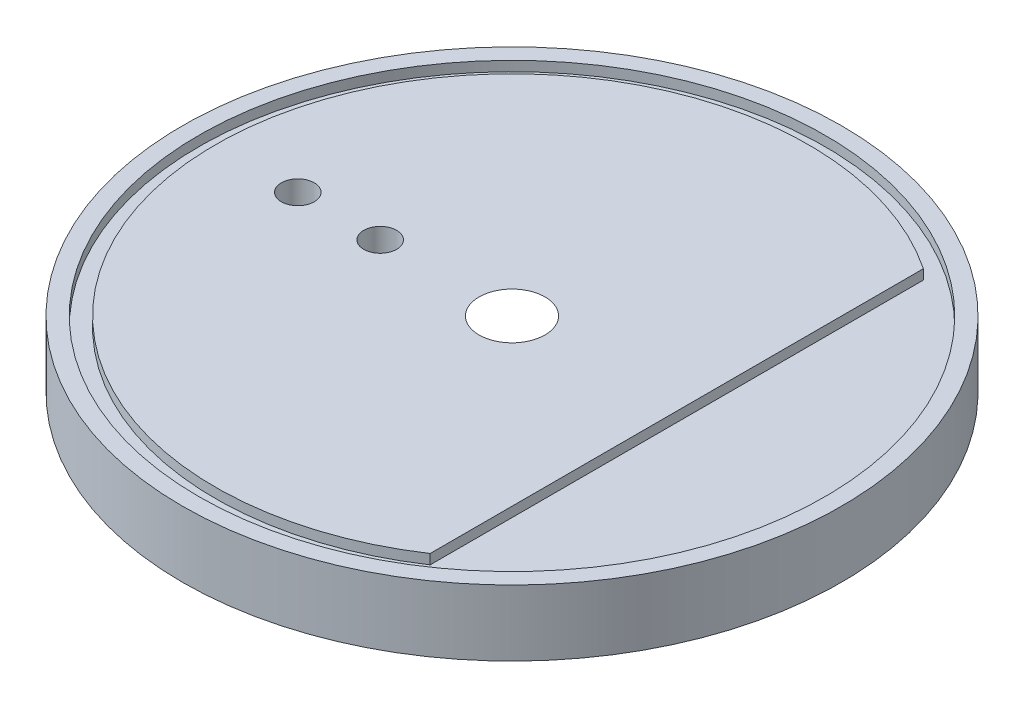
SolidWorks part; units mm, degrees
ref_plane "Front Plane" through (0, 0, 0) normal (0, 0, 1) x (1, 0, 0)
ref_plane "Top Plane" through (0, 0, 0) normal (0, 1, 0) x (1, 0, 0)
ref_plane "Right Plane" through (0, 0, 0) normal (1, 0, 0) x (0, 0, -1)
sketch "Sketch1" plane through (0, 0, 0) normal (0, 1, 0) x (1, 0, 0)
  circle A0 centre (0, 0) radius 100
extrude "Extrude1" add sketch "Sketch1" against normal blind 20
sketch "Sketch2" plane through (0, 0, 0) normal (0, 1, 0) x (-1, 0, 0)
  line L0 (-50, -74.8331) -> (-50, 74.8331)
  circle A0 centre (0, 0) radius 95
  arc A1 (-50, -74.8331) -> (-50, 74.8331) centre (0, 0) ccw
extrude "Cut-Extrude1" cut sketch "Sketch2" against normal blind 3
sketch "Sketch3" plane through (0, -20, 0) normal (0, -1, 0) x (1, 0, 0)
  circle A0 centre (0, 0) radius 90
extrude "Cut-Extrude2" cut sketch "Sketch3" against normal blind 10
sketch "Sketch12" plane through (0, 0, 0) normal (0, 1, 0) x (-1, 0, 0)
  circle A0 centre (0, 0) radius 10
extrude "Cut-Extrude3" cut sketch "Sketch12" against normal blind 10 draft 60
sketch "Sketch14" plane through (0, 0, 0) normal (0, 1, 0) x (-1, 0, 0)
  circle A1 centre (40, 0) radius 5
  circle A2 centre (65, 0) radius 5
extrude "Cut-Extrude5" cut sketch "Sketch14" against normal blind 10
